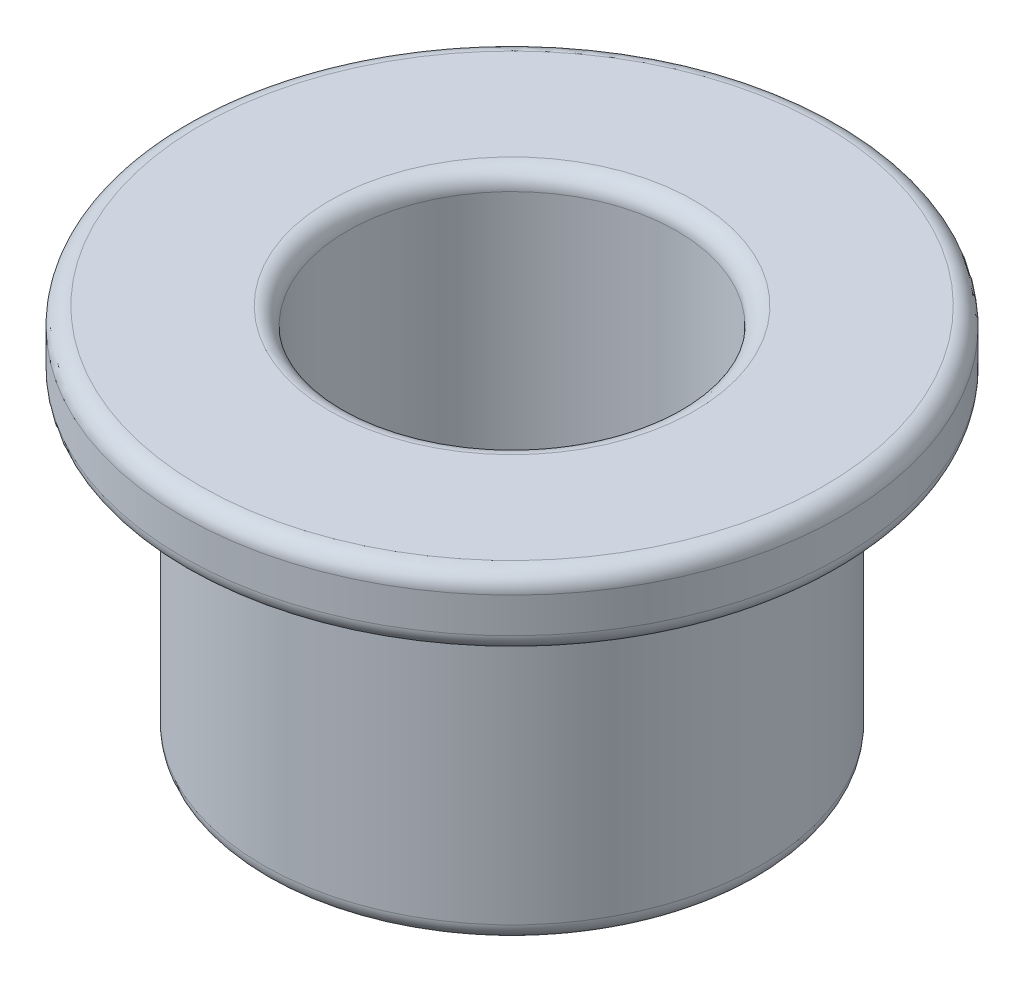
SolidWorks part; units mm, degrees
ref_plane "Front" through (0, 0, 0) normal (0, 0, 1) x (1, 0, 0)
ref_plane "Top" through (0, 0, 0) normal (0, 1, 0) x (1, 0, 0)
ref_plane "Right" through (0, 0, 0) normal (1, 0, 0) x (0, 0, -1)
sketch "Sketch1" plane through (0, 0, 0) normal (0, 1, 0) x (1, 0, 0)
  circle A0 centre (0, 0) radius 3.5941
  dimension "D1" = 7.1882
extrude "Extrude1" add sketch "Sketch1" along normal blind 4.445
sketch "Sketch2" plane through (0, 4.445, 0) normal (0, 1, 0) x (-1, 0, 0)
  circle A0 centre (0, 0) radius 4.7625
  dimension "D1" = 9.525
extrude "Extrude2" add sketch "Sketch2" along normal blind 1.016
sketch "Sketch3" plane through (0, 5.461, 0) normal (0, 1, 0) x (-1, 0, 0)
  circle A0 centre (0, 0) radius 2.3813
  dimension "D1" = 4.7625
extrude "Cut-Extrude1" cut sketch "Sketch3" against normal through all
fillet "Fillet1" radius 0.254 6 edges at (0, 0, 2.3813) (0, 5.461, 2.3813) (0, 0, 3.5941) (0, 4.445, 3.5941) (0, 4.445, 4.7625) (0, 5.461, 4.7625)
